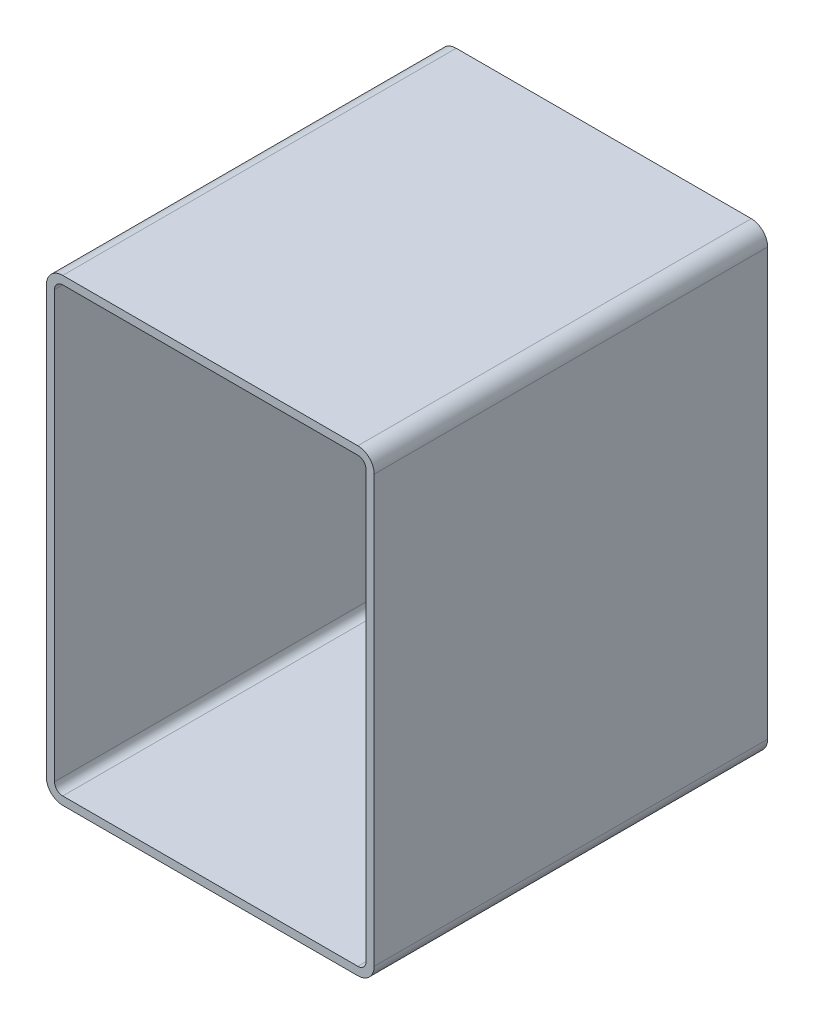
SolidWorks part; units mm, degrees
ref_plane "Front Plane" through (0, 0, 0) normal (0, 0, 1) x (1, 0, 0)
ref_plane "Top Plane" through (0, 0, 0) normal (0, 1, 0) x (1, 0, 0)
ref_plane "Right Plane" through (0, 0, 0) normal (1, 0, 0) x (0, 0, -1)
sketch "Sketch1" plane through (0, 0, 0) normal (0, 0, 1) x (1, 0, 0)
sketch_block_instance "HSS14x10x0.250-1"
sketch_block "HSS14x10x0.250"
extrude "Boss-Extrude1" add sketch "Sketch1" along normal blind 304.8
